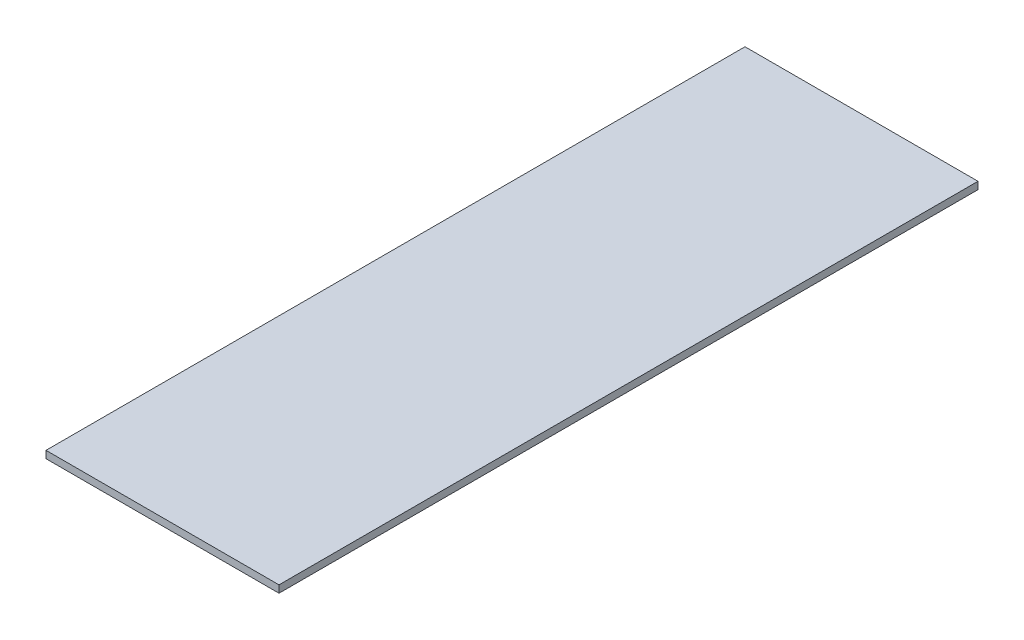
SolidWorks part; units mm, degrees
ref_plane "Front Plane" through (0, 0, 0) normal (0, 0, 1) x (1, 0, 0)
ref_plane "Top Plane" through (0, 0, 0) normal (0, 1, 0) x (1, 0, 0)
ref_plane "Right Plane" through (0, 0, 0) normal (1, 0, 0) x (0, 0, -1)
sketch "Sketch1" plane through (0, 0, 0) normal (0, 1, 0) x (1, 0, 0)
  line L1 (-76.2, -228.6) -> (76.2, -228.6)
  line L2 (-76.2, -228.6) -> (-76.2, 228.6)
  line L3 (-76.2, 228.6) -> (76.2, 228.6)
  line L4 (76.2, -228.6) -> (76.2, 228.6)
  line L5 (-76.2, -228.6) -> (76.2, 228.6) construction
  line L6 (-76.2, 228.6) -> (76.2, -228.6) construction
  point P0 (0, 0)
  dimension "D1" = 152.4
  dimension "D2" = 457.2
extrude "Boss-Extrude1" add sketch "Sketch1" along normal blind 4.7625
